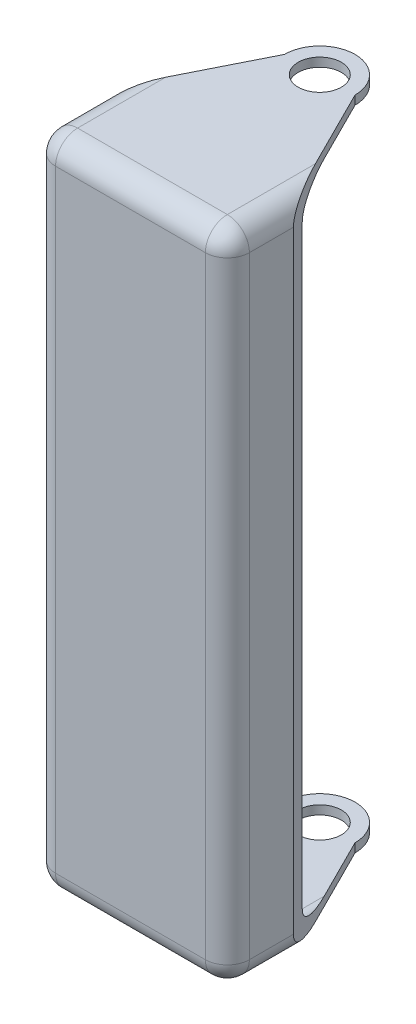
SolidWorks part; units mm, degrees
ref_plane "Front Plane" through (0, 0, 0) normal (0, 0, 1) x (1, 0, 0)
ref_plane "Top Plane" through (0, 0, 0) normal (0, 1, 0) x (1, 0, 0)
ref_plane "Right Plane" through (0, 0, 0) normal (1, 0, 0) x (0, 0, -1)
sketch "Sketch1" plane through (0, 0, 0) normal (0, 1, 0) x (1, 0, 0)
  line L0 (-30.4774, -27.4721) -> (20.3226, -27.4721)
  line L2 (-30.4774, -5.8821) -> (-30.4774, -27.4721)
  line L4 (20.3226, -5.8821) -> (20.3226, -27.4721)
  line L7 (-15.2374, 24.5664) -> (-30.4774, -5.8821)
  line L8 (-5.0774, -27.4721) -> (-5.0774, 34.7264) construction
  line L9 (20.3226, -5.8821) -> (5.0826, 24.5664)
  arc A1 (5.0826, 24.5664) -> (-15.2374, 24.5664) centre (-5.0774, 24.5664) ccw
  point P4 (0, 0)
  dimension "D2" = 21.59
  dimension "D1" = 50.8
extrude "Boss-Extrude4" add sketch "Sketch1" along normal blind 184.15
shell "Shell2" thickness 2.54
sketch "Sketch12" plane through (0, 186.69, 0) normal (0, 1, 0) x (1, 0, 0)
  circle A0 centre (-5.0774, 24.5664) radius 6.2265
extrude "Cut-Extrude1" cut sketch "Sketch12" against normal blind 190.5
fillet "Fillet4" radius 6.35 16 edges at (-33.0174, 186.69, 20.4845) (-33.0174, -2.54, 20.4845) (22.8626, -2.54, 20.4845) (22.8626, 186.69, 20.4845) (20.3226, 184.15, 16.6771) (-30.4774, 0, 16.6771) (20.3226, 0, 16.6771) (-30.4774, 184.15, 16.6771) (20.3226, 92.075, 27.4721) (-5.0774, 184.15, 27.4721) (-30.4774, 92.075, 27.4721) (-5.0774, 0, 27.4721) (-5.0774, -2.54, 30.0121) (-33.0174, 92.075, 30.0121) (-5.0774, 186.69, 30.0121) (22.8626, 92.075, 30.0121)
